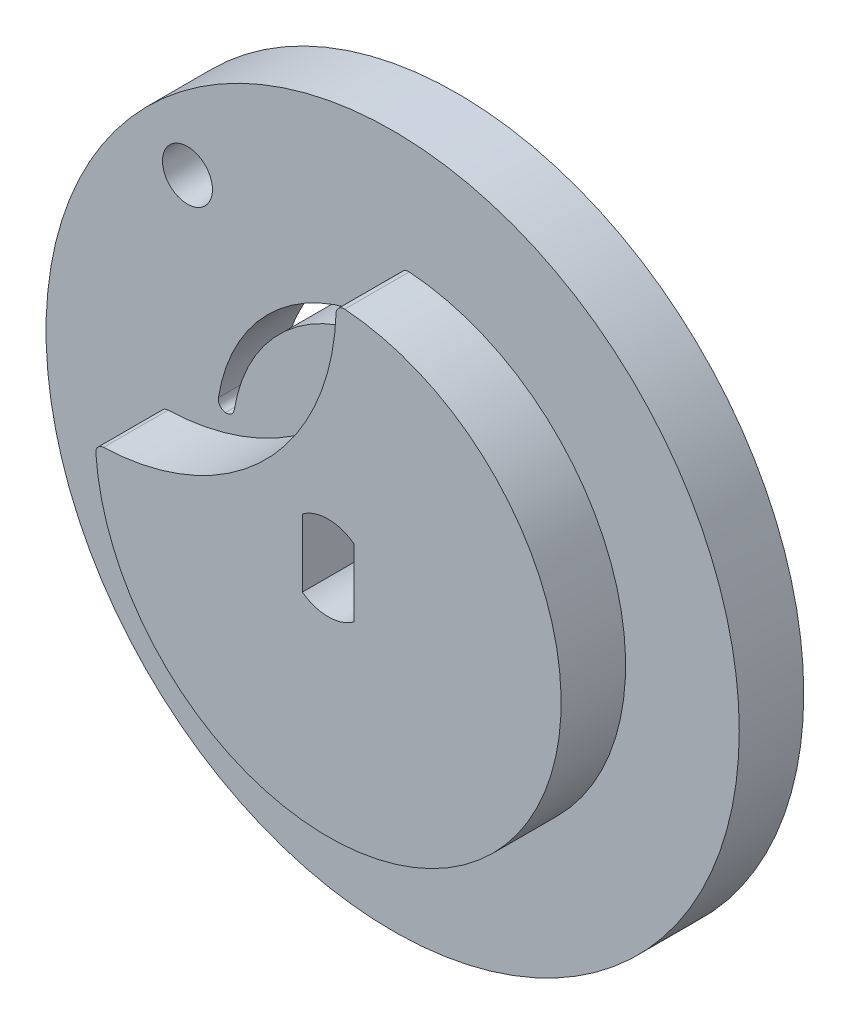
SolidWorks part; units mm, degrees
ref_plane "Front Plane" through (0, 0, 0) normal (0, 0, 1) x (1, 0, 0)
ref_plane "Top Plane" through (0, 0, 0) normal (0, 1, 0) x (1, 0, 0)
ref_plane "Right Plane" through (0, 0, 0) normal (1, 0, 0) x (0, 0, -1)
sketch "Sketch2" plane through (0, 0, 0) normal (0, 0, 1) x (1, 0, 0)
  line L0 (-25.4558, 0) -> (-12.7279, 12.7279) construction
  line L1 (-12.7279, 12.7279) -> (0, 0) construction
  line L2 (-25.4558, 0) -> (0, 0) construction
  line L3 (-14.45, 0) -> (-14.45, 14.45) construction
  line L4 (0, 0) -> (-1.6107, 14.3599) construction
  line L5 (0, 0) -> (-14.3599, 1.6107) construction
  line L6 (0, 0) -> (0, 14.45) construction
  circle A0 centre (0, 0) radius 14.45 construction
  circle A1 centre (0, 0) radius 18 construction
  arc A2 (-14.4413, -0.4999) -> (0.4999, 14.4413) centre (-14.45, 14.45) ccw construction
  circle A3 centre (0, 0) radius 21.5 construction
  arc A4 (-10.8818, 1.2206) -> (-1.2206, 10.8818) centre (0, 0) cw construction
  arc A5 (-9.888, 1.1091) -> (-1.1091, 9.888) centre (0, 0) cw construction
  point P5 (-14.45, 0)
  dimension "D3" = 28.9
  dimension "D5" = 43
  dimension "D6" = 3.5
  dimension "D9" = 1
  dimension "D1" = 45
  dimension "D2" = 18
  dimension "D4" = 0.5
  dimension "D7" = 6.4
  dimension "D8" = 6.4
sketch "Sketch4" plane through (0, 0, 0) normal (0, 0, 1) x (1, 0, 0)
  line L0 (-1.6, 0) -> (1.6, 0) construction
  line L1 (-1.6, -2.1) -> (-1.6, 2.1)
  line L2 (1.6, -2.1) -> (1.6, 2.1)
  line L6 (0, 0) -> (-1.6107, 14.3599) construction
  line L7 (-10.8818, 1.2206) -> (-9.888, 1.1091)
  line L8 (-1.2206, 10.8818) -> (-1.1091, 9.888)
  circle A0 centre (0, 0) radius 21.5
  circle A1 centre (0, 0) radius 21.5 construction
  circle A3 centre (-12.7279, 12.7279) radius 1.55
  arc A4 (-1.6, 2.1) -> (1.6, 2.1) centre (0, -0.0749) cw
  arc A5 (-1.6, -2.1) -> (1.6, -2.1) centre (0, 0.0749) ccw
  arc A6 (-10.8818, 1.2206) -> (-1.2206, 10.8818) centre (0, 0) cw
  arc A7 (-1.2206, 10.8818) -> (-10.8818, 1.2206) centre (0, 0) ccw construction
  arc A9 (-9.888, 1.1091) -> (-1.1091, 9.888) centre (0, 0) cw
  point P11 (0, 0)
  point P13 (-1.6, 0)
  point P17 (1.6, 0)
  dimension "D1" = 2.7
  dimension "D2" = 3.1
  dimension "D3" = 3.2
  dimension "D4" = 4.2
extrude "Boss-Extrude1" add sketch "Sketch4" along normal blind 4
sketch "Sketch5" plane through (0, 0, 4) normal (0, 0, 1) x (1, 0, 0)
  line L4 (-1.6, 0) -> (1.6, 0) construction
  line L5 (1.6, -2.1) -> (1.6, 2.1) construction
  line L6 (1.6, -2.1) -> (1.6, 2.1)
  line L7 (-1.6, -2.1) -> (-1.6, 2.1)
  arc A0 (-14.4413, -0.4999) -> (0.4999, 14.4413) centre (0, 0) ccw
  circle A1 centre (0, 0) radius 14.45 construction
  arc A4 (-14.4413, -0.4999) -> (0.4999, 14.4413) centre (-14.45, 14.45) ccw
  arc A5 (-14.4413, -0.4999) -> (0.4999, 14.4413) centre (-14.45, 14.45) ccw construction
  arc A8 (-1.6, 2.1) -> (1.6, 2.1) centre (0, -0.0749) cw
  arc A12 (1.6, 2.1) -> (-1.6, 2.1) centre (0, -0.0749) ccw construction
  arc A13 (-1.6, -2.1) -> (1.6, -2.1) centre (0, 0.0749) ccw
  point P17 (0, 0)
  point P35 (1.6, 0)
  point P39 (-1.6, 0)
  dimension "D1" = 2.7
extrude "Boss-Extrude2" add sketch "Sketch5" along normal blind 4
sketch "Sketch7" plane through (0, 0, 0) normal (0, 0, -1) x (-1, 0, 0)
  arc A2 (1.6, 2.1) -> (-1.6, 2.1) centre (0, -0.0749) ccw construction
  arc A3 (1.6, 2.1) -> (-1.6, 2.1) centre (0, -0.0749) ccw
  circle A4 centre (0, 0) radius 2.6251
extrude "Cut-Extrude1" cut sketch "Sketch7" against normal blind 1.2 contours A4 M7 | A4 M5
fillet "Fillet1" radius 0.5 6 edges at (-9.888, 1.1091, 2) (-10.8818, 1.2206, 2) (-1.1091, 9.888, 2) (-1.2206, 10.8818, 2) (0.4999, 14.4413, 6) (-14.4413, -0.4999, 6)
equation "\"1.5.00mm\"=10"
